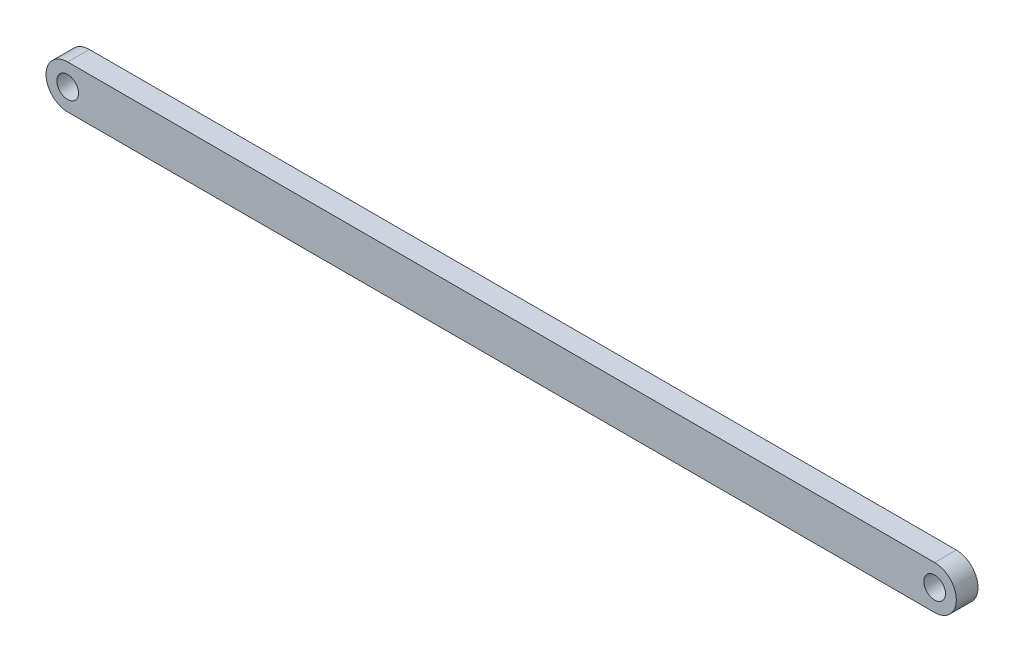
SolidWorks part; units mm, degrees
ref_plane "Front Plane" through (0, 0, 0) normal (0, 0, 1) x (1, 0, 0)
ref_plane "Top Plane" through (0, 0, 0) normal (0, 1, 0) x (1, 0, 0)
ref_plane "Right Plane" through (0, 0, 0) normal (1, 0, 0) x (0, 0, -1)
sketch "Sketch1" plane through (0, 0, 0) normal (0, 0, 1) x (1, 0, 0)
  line L0 (0, 0) -> (127, 0) construction
  line L1 (0, 3.175) -> (127, 3.175)
  line L2 (0, -3.175) -> (127, -3.175)
  arc A0 (0, 3.175) -> (0, -3.175) centre (0, 0) ccw
  arc A1 (127, -3.175) -> (127, 3.175) centre (127, 0) ccw
  circle A2 centre (0, 0) radius 1.5875
  circle A3 centre (127, 0) radius 1.5875
  point P3 (63.5, 0)
  dimension "D1" = 3.175
  dimension "D3" = 3.175
  dimension "D2" = 127
extrude "Boss-Extrude1" add sketch "Sketch1" along normal blind 3.175
